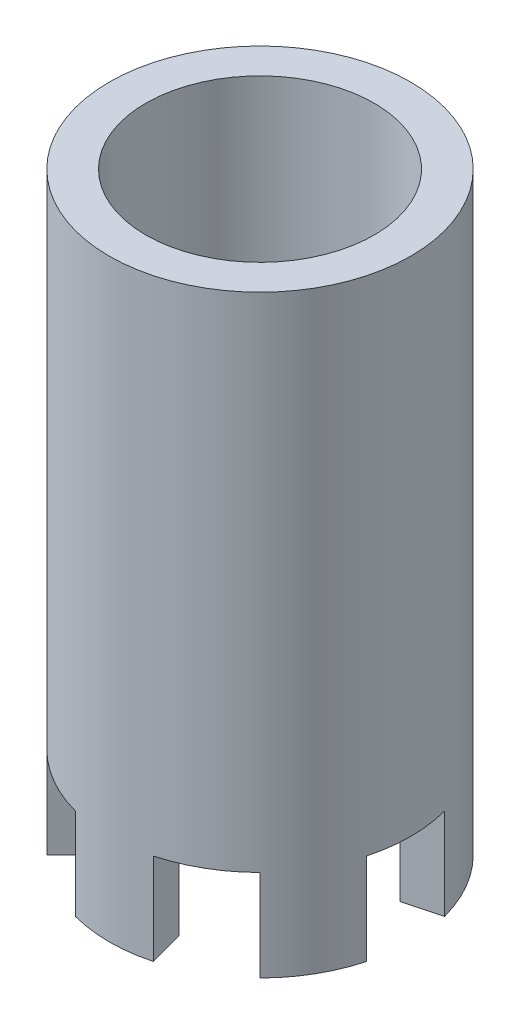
SolidWorks part; units mm, degrees
ref_plane "Front Plane" through (0, 0, 0) normal (0, 0, 1) x (1, 0, 0)
ref_plane "Top Plane" through (0, 0, 0) normal (0, 1, 0) x (1, 0, 0)
ref_plane "Right Plane" through (0, 0, 0) normal (1, 0, 0) x (0, 0, -1)
sketch "Sketch2" plane through (0, 0, 0) normal (0, 1, 0) x (1, 0, 0)
  circle A0 centre (0, 0) radius 3.3
  circle A1 centre (0, 0) radius 2.5
  dimension "D1" = 6.6
  dimension "D2" = 5
extrude "Boss-Extrude1" add sketch "Sketch2" along normal blind 11
sketch "Sketch3" plane through (0, 0, 0) normal (0, -1, 0) x (1, 0, 0)
  line L0 (0, 0) -> (0, 3.3) construction
  line L1 (0, 0) -> (0.8541, 3.1876) construction
  line L2 (0, 0) -> (-0.8541, 3.1876) construction
  line L3 (-0.647, 2.4148) -> (-0.8541, 3.1876)
  line L4 (0.647, 2.4148) -> (0.8541, 3.1876)
  line L5 (1.7678, 1.7678) -> (2.3335, 2.3335)
  line L6 (2.4148, 0.647) -> (3.1876, 0.8541)
  line L7 (2.4148, -0.647) -> (3.1876, -0.8541)
  line L8 (1.7678, -1.7678) -> (2.3335, -2.3335)
  line L9 (0.647, -2.4148) -> (0.8541, -3.1876)
  line L10 (-0.647, -2.4148) -> (-0.8541, -3.1876)
  line L11 (-1.7678, -1.7678) -> (-2.3335, -2.3335)
  line L12 (-2.4148, -0.647) -> (-3.1876, -0.8541)
  line L13 (-2.4148, 0.647) -> (-3.1876, 0.8541)
  line L14 (-1.7678, 1.7678) -> (-2.3335, 2.3335)
  circle A0 centre (0, 0) radius 3.3 construction
  arc A1 (-0.647, 2.4148) -> (0.647, 2.4148) centre (0, 0) cw
  circle A2 centre (0, 0) radius 2.5 construction
  arc A3 (-0.8541, 3.1876) -> (0.8541, 3.1876) centre (0, 0) cw
  arc A4 (2.3335, 2.3335) -> (3.1876, 0.8541) centre (0, 0) cw
  arc A5 (1.7678, 1.7678) -> (2.4148, 0.647) centre (0, 0) cw
  arc A6 (3.1876, -0.8541) -> (2.3335, -2.3335) centre (0, 0) cw
  arc A7 (2.4148, -0.647) -> (1.7678, -1.7678) centre (0, 0) cw
  arc A8 (0.8541, -3.1876) -> (-0.8541, -3.1876) centre (0, 0) cw
  arc A9 (0.647, -2.4148) -> (-0.647, -2.4148) centre (0, 0) cw
  arc A10 (-2.3335, -2.3335) -> (-3.1876, -0.8541) centre (0, 0) cw
  arc A11 (-1.7678, -1.7678) -> (-2.4148, -0.647) centre (0, 0) cw
  arc A12 (-3.1876, 0.8541) -> (-2.3335, 2.3335) centre (0, 0) cw
  arc A13 (-2.4148, 0.647) -> (-1.7678, 1.7678) centre (0, 0) cw
  point P40 (0, 0)
  dimension "D1" = 15
  dimension "D2" = 15
extrude "Boss-Extrude2" add sketch "Sketch3" along normal blind 2
